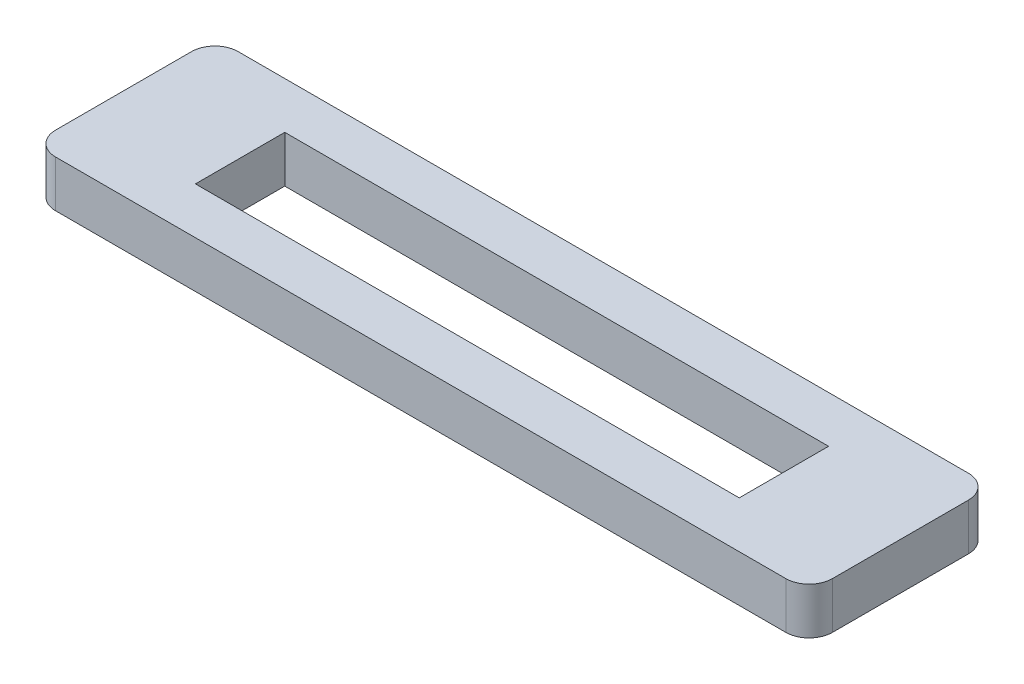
SolidWorks part; units mm, degrees
ref_plane "Front Plane" through (0, 0, 0) normal (0, 0, 1) x (1, 0, 0)
ref_plane "Top Plane" through (0, 0, 0) normal (0, 1, 0) x (1, 0, 0)
ref_plane "Right Plane" through (0, 0, 0) normal (1, 0, 0) x (0, 0, -1)
sketch "Sketch1" plane through (0, 0, 0) normal (0, 1, 0) x (1, 0, 0)
  line L1 (-50, 11.75) -> (50, 11.75)
  line L2 (-50, 11.75) -> (-50, -11.75)
  line L3 (-50, -11.75) -> (50, -11.75)
  line L4 (50, 11.75) -> (50, -11.75)
  line L5 (-50, 11.75) -> (50, -11.75) construction
  line L6 (-50, -11.75) -> (50, 11.75) construction
  line L7 (-35, 5.75) -> (35, 5.75)
  line L8 (-35, 5.75) -> (-35, -5.75)
  line L9 (-35, -5.75) -> (35, -5.75)
  line L10 (35, 5.75) -> (35, -5.75)
  line L11 (-35, 5.75) -> (35, -5.75) construction
  line L12 (-35, -5.75) -> (35, 5.75) construction
  point P0 (0, 0)
  point P6 (0, 0)
  dimension "D1" = 70
  dimension "D2" = 100
  dimension "D3" = 6
  dimension "D4" = 11.5
extrude "Boss-Extrude1" add sketch "Sketch1" along normal blind 6
fillet "Fillet1" radius 3 4 edges at (50, 3, -11.75) (50, 3, 11.75) (-50, 3, -11.75) (-50, 3, 11.75)
